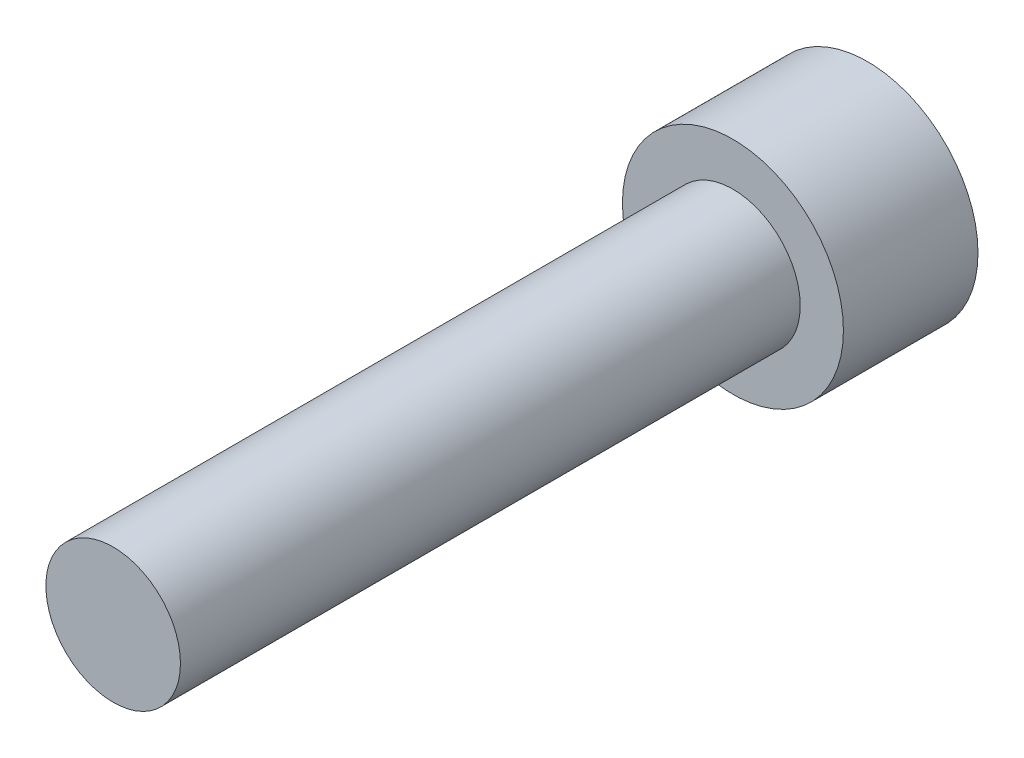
SolidWorks part; units mm, degrees
ref_plane "Front Plane" through (0, 0, 0) normal (0, 0, 1) x (1, 0, 0)
ref_plane "Top Plane" through (0, 0, 0) normal (0, 1, 0) x (1, 0, 0)
ref_plane "Right Plane" through (0, 0, 0) normal (1, 0, 0) x (0, 0, -1)
sketch "Sketch6" plane through (0, 0, 0) normal (1, 0, 0) x (0, 0, -1)
  line L0 (-22.225, 0) -> (22.525, 0) construction
  line L1 (4.3586, 0) -> (-4.3586, 0) construction
  line L2 (-22.225, 0) -> (-22.225, -2.413)
  line L3 (-22.225, -2.413) -> (0, -2.413)
  line L4 (0, 4.3586) -> (0, -4.3586) construction
  line L5 (0, -2.413) -> (0, -3.9624)
  line L6 (0, -3.9624) -> (4.826, -3.9624)
  line L7 (4.826, -3.9624) -> (4.826, 0)
  line L8 (4.826, 0) -> (-22.225, 0)
  dimension "L" = 22.225
  dimension "H" = 4.826
  dimension "A" = 7.9248
  dimension "D" = 4.826
revolve "Revolve1" add sketch "Sketch6" angle 360 about L0
sketch "Sketch7" plane through (0, 0, -4.826) normal (0, 0, -1) x (-1, 0, 0)
  line L2 (-1.9812, 1.1438) -> (-1.9812, -1.1438)
  line L4 (-1.9812, -1.1438) -> (0, -2.2877)
  line L5 (0, -2.2877) -> (1.9812, -1.1438)
  line L6 (1.9812, -1.1438) -> (1.9812, 1.1438)
  line L7 (1.9812, 1.1438) -> (0, 2.2877)
  line L8 (0, 2.2877) -> (-1.9812, 1.1438)
  circle A0 centre (0, 0) radius 1.9812 construction
  dimension "J" = 3.9624
extrude "HEX" cut sketch "Sketch7" against normal blind 3.048
